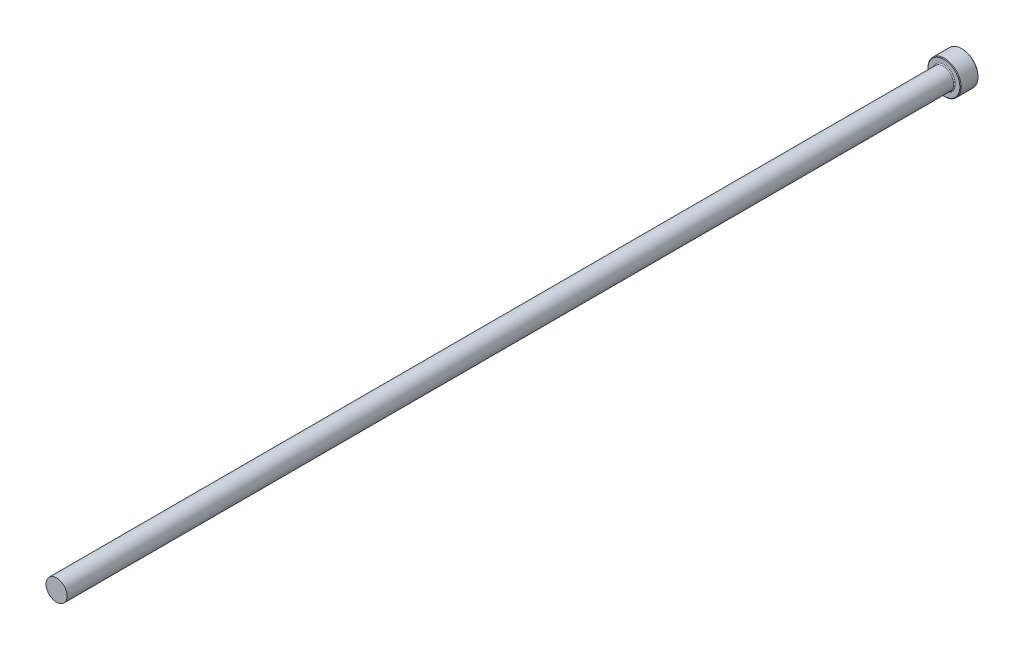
SolidWorks part; units mm, degrees
ref_plane "Front Plane" through (0, 0, 0) normal (0, 0, 1) x (1, 0, 0)
ref_plane "Top Plane" through (0, 0, 0) normal (0, 1, 0) x (1, 0, 0)
ref_plane "Right Plane" through (0, 0, 0) normal (1, 0, 0) x (0, 0, -1)
sketch "Sketch1" plane through (0, 0, 0) normal (1, 0, 0) x (0, 0, -1)
  line L0 (0, 0) -> (0, 5.5)
  line L1 (0, 6.05) -> (0, -6.05) construction
  line L2 (0, 5.5) -> (-6, 5.5)
  line L3 (-6, 5.5) -> (-6, 3.8)
  line L4 (-6.3, 3.5) -> (-300, 3.5)
  line L5 (-300, 3.5) -> (-300, 0)
  line L6 (6.05, 0) -> (-6.05, 0) construction
  line L7 (-300, 0) -> (0, 0)
  line L8 (-109.0506, 0) -> (16.9928, 0) construction
  arc A0 (-6, 3.8) -> (-6.3, 3.5) centre (-6.3, 3.8) cw
  dimension "D1" = 0.3
  dimension "D2" = 11
  dimension "D3" = 7
  dimension "D4" = 300
  dimension "D5" = 6
revolve "Revolve1" add sketch "Sketch1" angle 360 about L8
chamfer "Chamfer1" distance 0.2 angle 45 2 edges at (5.5, 0, 0) (5.5, 0, 6)
